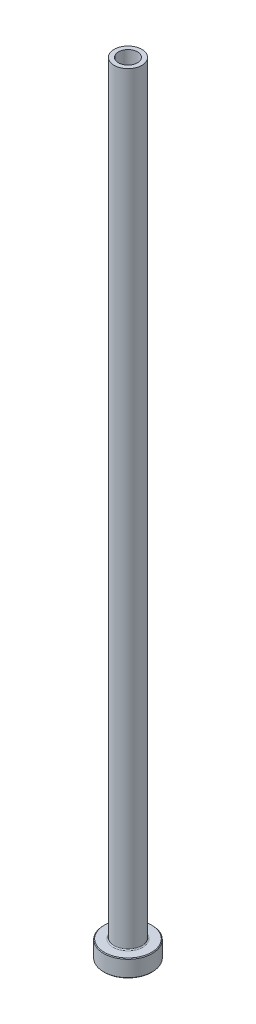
SolidWorks part; units mm, degrees
ref_plane "Front Plane" through (0, 0, 0) normal (0, 0, 1) x (1, 0, 0)
ref_plane "Top Plane" through (0, 0, 0) normal (0, 1, 0) x (1, 0, 0)
ref_plane "Right Plane" through (0, 0, 0) normal (1, 0, 0) x (0, 0, -1)
sketch "Sketch1" plane through (0, 0, 0) normal (0, 0, 1) x (1, 0, 0)
  line L0 (-2.75, 225) -> (-4, 225)
  line L1 (-4, 225) -> (-4, 5)
  line L2 (-4, 5) -> (-7, 5)
  line L3 (-7, 5) -> (-7, 0)
  line L4 (7.7, 0) -> (-7.7, 0) construction
  line L5 (-7, 0) -> (-3, 0)
  line L6 (-2.75, 180) -> (-2.75, 225)
  line L7 (0, 92.1877) -> (0, -15.5353) construction
  line L8 (0, -7.7) -> (0, 7.7) construction
  line L9 (-2.75, 180) -> (-3, 168)
  line L10 (-3, 168) -> (-3, 0)
  dimension "D1" = 0.25
  dimension "ID" = 5.5
  dimension "OD" = 8
  dimension "L" = 225
  dimension "H" = 14
  dimension "T" = 5
  dimension "N" = 45
  dimension "D2" = 12
revolve "Revolve1" add sketch "Sketch1" angle 360 about L7
fillet "Fillet1" radius 0.3 1 edges at (0, 5, 4)
chamfer "Chamfer1" distance 0.2 angle 45 2 edges at (0, 5, 7) (0, 0, 7)
chamfer "Chamfer3" distance 0.5 angle 45 1 edges at (0, 0, 3)
